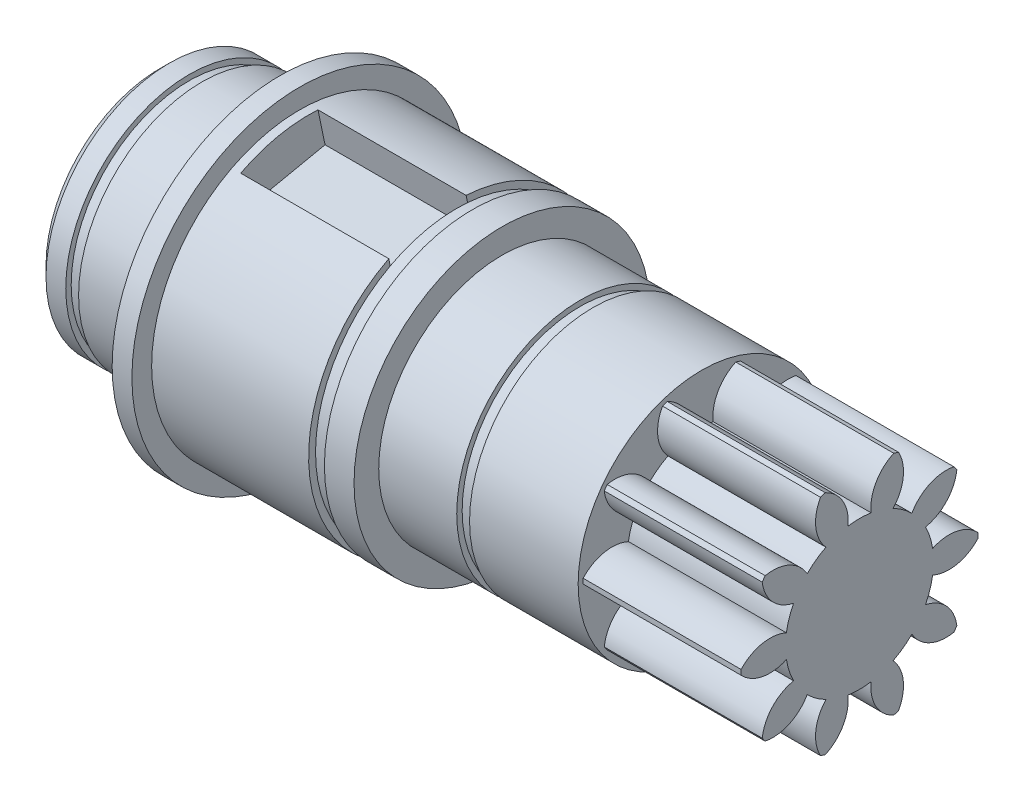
SolidWorks part; units mm, degrees
ref_plane "Plane1" through (0, 0, 0) normal (0, 0, 1) x (1, 0, 0)
ref_plane "Plane2" through (0, 0, 0) normal (0, 1, 0) x (1, 0, 0)
ref_plane "Plane3" through (0, 0, 0) normal (1, 0, 0) x (0, 0, -1)
sketch "HoldingSke" plane through (0, 0, 0) normal (0, 1, 0) x (1, 0, 0)
  line L0 (0, 0) -> (0.4924, -0.0868)
  line L1 (-15, 0) -> (100, 0) construction
  line L2 (0, 0) -> (-2.1039, 2.3779)
  line L3 (0, 0) -> (-11.863, 4.5341)
  line L4 (0, 0) -> (8.5048, 1.4996)
  line L5 (0, 0) -> (-46.8476, -17.4728)
  line L6 (0, 0) -> (-13.2634, -8.9489)
  line L7 (-2.1039, 2.3779) -> (8.6586, 51.2059)
  line L8 (-76.2, 54.61) -> (-73.9, 54.61)
  line L9 (-71.009, 38.7566) -> (-53.1078, 45.2721)
  line L10 (-76.2, 71.12) -> (104.1128, 71.12)
  line L11 (0, 0) -> (-16, 0)
  line L12 (-76.2, 101.6) -> (-76.133, 101.6)
  line L13 (24.9733, 27.94) -> (52.9518, 28.4284)
  line L14 (24.9733, 27.94) -> (24.9743, 27.94)
  line L15 (24.9733, 27.94) -> (100.4006, 29.5858)
  line L16 (-63.627, -2) -> (-12.827, -2)
  circle A0 centre (0, 0) radius 8
  circle A1 centre (0, 0) radius 7.499
  circle A2 centre (0, 0) radius 37.5
  circle A3 centre (0, 0) radius 7.4736
  dimension "MHD" = 14.998
  dimension "Hub_dia" = 75
  dimension "Bore" = 16
  dimension "MBD" = 14.9472
  dimension "Num_teeth" = 10
  dimension "Pitch_radius" = 180.3128
  dimension "Pitch" = 0.5
  dimension "Width" = 16
  dimension "Overall_len" = 50
  dimension "Show_teeth" = 10
  dimension "Thickness" = 16
  dimension "OAL" = 50.0001
  dimension "T_dim" = 2.3
  dimension "Ap" = 20
  dimension "H" = 19.05
  dimension "Backlash" = 0.067
  dimension "Addendum_fac" = 1
  dimension "Dedendum_fac" = 1.25
  dimension "Clearance_fac" = 0.25
  dimension "Dedendum_add" = 0.001
  dimension "Module" = 2
sketch "BasProSke" plane through (0, 0, 0) normal (0, 1, 0) x (1, 0, 0)
  line L0 (-10, 0) -> (60, 0) construction
  line L1 (0, 0) -> (0, 12)
  line L2 (0, 0) -> (16, 0)
  line L3 (16, 0) -> (16, 12)
  line L4 (16, 12) -> (0, 12)
  dimension "Diameter" = 24
  dimension "Thickness" = 16
revolve "Base-Revolve" add sketch "BasProSke" angle 360 about L0
sketch "TooCutSke" plane through (0, 0, 0) normal (1, 0, 0) x (0, 0, -1)
  line L1 (0, 0) -> (0, 107) construction
  line L2 (0, 0) -> (-1.6814, 9.8576) construction
  line L3 (0, 0) -> (-6.1153, 18.8209) construction
  line L4 (-1.6814, 9.8576) -> (-3.0576, 9.4105) construction
  arc A0 (1.1737, 7.4066) -> (-1.1737, 7.4066) centre (0, 0) ccw
  arc A1 (3.4979, 11.5054) -> (-3.4979, 11.5054) centre (0, 0) ccw
  circle A2 centre (0, 0) radius 10 construction
  circle A3 centre (0, 0) radius 9.3969 construction
  arc A4 (-1.1737, 7.4066) -> (-3.4979, 11.5054) centre (-5.1477, 7.8615) ccw
  arc A5 (3.4979, 11.5054) -> (1.1737, 7.4066) centre (5.1477, 7.8615) ccw
  dimension "Root_dia" = 14.998
  dimension "Overcut_dia" = 24.0508
  dimension "Pitch_dia" = 20
  dimension "Base_dia" = 18.7939
  dimension "Flank_rad" = 4
  dimension "Half_ang" = 18
  dimension "Half_CT" = 1.4471
extrude "ToothCut" cut sketch "TooCutSke" along normal through all
fillet "Breaks" [suppressed] radius 0.04
fillet "RootFillets" [suppressed] radius 0.501
pattern_circular "TeethCuts" count 10 every 36 about axis through (-10, 0, 0) along (1, 0, 0) of "ToothCut", "RootFillets", "Breaks"
sketch "HubNeaOneSke" plane through (0, 0, 0) normal (-1, 0, 0) x (0, 0, 1)
  circle A0 centre (0, 0) radius 7.499
  dimension "Diameter" = 14.998
extrude "HubNearOne" [suppressed] add sketch "HubNeaOneSke" along normal blind 34.0001
sketch "HubNeaBotSke" plane through (0, 0, 0) normal (-1, 0, 0) x (0, 0, 1)
  circle A0 centre (0, 0) radius 7.499
  dimension "Diameter" = 14.998
extrude "HubNearBoth" [suppressed] add sketch "HubNeaBotSke" along normal blind 17
ref_plane "FarPln" through (16, 0, 0) normal (1, 0, 0) x (0, 0, -1)
sketch "HubFarSke" plane through (16, 0, 0) normal (1, 0, 0) x (0, 0, -1)
  circle A0 centre (0, 0) radius 7.499
  dimension "Diameter" = 14.998
extrude "HubFar" [suppressed] add sketch "HubFarSke" along normal blind 17
sketch "BorSke" plane through (0, 0, 0) normal (1, 0, 0) x (0, 0, -1)
  circle A0 centre (0, 0) radius 7.4736
  dimension "Diameter" = 14.9472
extrude "Bore" cut sketch "BorSke" along normal mid plane 100.0001
sketch "KeySke" plane through (0, 0, 0) normal (1, 0, 0) x (0, 0, -1)
  line L0 (-2.5, 0) -> (-2.5, 9.7736)
  line L1 (-2.5, 9.7736) -> (2.5, 9.7736)
  line L2 (2.5, 9.7736) -> (2.5, 0)
  line L3 (0, 0) -> (0, 34) construction
  line L4 (-2.5, 0) -> (2.5, 0)
  dimension "Offset" = 9.7736
  dimension "Width" = 5
extrude "Keyway" [suppressed] cut sketch "KeySke" along normal mid plane 100.0001
pattern_circular "Keyway2" [suppressed] count 2 every 90 about axis through (-10, 0, 0) along (1, 0, 0)
sketch "Esquisse1" plane through (16, 0, 0) normal (1, 0, 0) x (0, 0, -1)
  circle A0 centre (0, 0) radius 7.4736
  circle A2 centre (0, 0) radius 7.4736 construction
extrude "Extrusion2" add sketch "Esquisse1" against normal blind 16
sketch "Esquisse2" plane through (0, 0, 0) normal (-1, 0, 0) x (0, 0, 1)
  circle A0 centre (0, 0) radius 12.5
  dimension "D1" = 25
extrude "Extrusion3" add sketch "Esquisse2" along normal blind 11
sketch "Esquisse3" plane through (-11, 0, 0) normal (-1, 0, 0) x (0, 0, 1)
  circle A0 centre (0, 0) radius 11.95
  dimension "D1" = 23.9
extrude "Extrusion4" add sketch "Esquisse3" along normal blind 1.3
sketch "Esquisse4" plane through (-12.3, 0, 0) normal (-1, 0, 0) x (0, 0, 1)
  circle A0 centre (0, 0) radius 12.5
  dimension "D1" = 25
extrude "Extrusion5" add sketch "Esquisse4" along normal blind 7.9
sketch "Esquisse5" plane through (-20.2, 0, 0) normal (-1, 0, 0) x (0, 0, 1)
  circle A0 centre (0, 0) radius 15
  dimension "D1" = 30
extrude "Extrusion6" add sketch "Esquisse5" along normal blind 3
sketch "Esquisse6" plane through (-23.2, 0, 0) normal (-1, 0, 0) x (0, 0, 1)
  circle A0 centre (0, 0) radius 14.3
  dimension "D1" = 28.6
extrude "Extrusion7" add sketch "Esquisse6" along normal blind 1.6
sketch "Esquisse7" plane through (-24.8, 0, 0) normal (-1, 0, 0) x (0, 0, 1)
  circle A0 centre (0, 0) radius 15
  dimension "D1" = 30
extrude "Extrusion8" add sketch "Esquisse7" along normal blind 15.9
sketch "Esquisse8" plane through (-40.7, 0, 0) normal (-1, 0, 0) x (0, 0, 1)
  circle A0 centre (0, 0) radius 17
  dimension "D1" = 34
extrude "Extrusion9" add sketch "Esquisse8" along normal blind 2
sketch "Esquisse9" plane through (-42.7, 0, 0) normal (-1, 0, 0) x (0, 0, 1)
  circle A0 centre (0, 0) radius 12.5
  dimension "D1" = 25
extrude "Extrusion11" add sketch "Esquisse9" along normal blind 7.9
sketch "Esquisse10" plane through (-50.6, 0, 0) normal (-1, 0, 0) x (0, 0, 1)
  circle A0 centre (0, 0) radius 11.95
  dimension "D1" = 23.9
extrude "Extrusion12" add sketch "Esquisse10" along normal blind 1.3
sketch "Esquisse11" plane through (-51.9, 0, 0) normal (-1, 0, 0) x (0, 0, 1)
  circle A0 centre (0, 0) radius 12.5
  dimension "D1" = 25
extrude "Extrusion13" add sketch "Esquisse11" along normal blind 3
chamfer "Chanfrein1" distance 1 angle 45 1 edges at (-54.9, 0, 12.5)
sketch "Esquisse12" plane through (-24.8, 0, 0) normal (1, 0, 0) x (0, 0, -1)
  line L0 (0.2289, 18.3955) -> (1.6658, 11.5446)
  line L1 (0.2289, 18.3955) -> (-7.6007, 16.7534)
  line L2 (-7.6007, 16.7534) -> (-6.1639, 9.9025)
  line L3 (-6.1639, 9.9025) -> (1.6658, 11.5446)
  dimension "D1" = 7
extrude "Enlèv. mat.-Extru.1" cut sketch "Esquisse12" against normal blind 15
equation "' \"Module@HoldingSke\" = 6.35"
equation "' \"Num_teeth@HoldingSke\" = 12"
equation "' \"Ap@HoldingSke\" =  20"
equation "' \"Width@HoldingSke\" = 0.5 * 25.4"
equation "' \"Hub_dia@HoldingSke\"= 1 * 25.4"
equation "' \"Overall_len@HoldingSke\" = 1.0 * 25.4"
equation "' \"Bore@HoldingSke\" = 0.75 * 25.4"
equation "' \"T_dim@HoldingSke\" = 0.1 * 25.4"
equation "' \"Width@KeySke\" = 0.25 * 25.4"
equation "' \"Show_teeth@HoldingSke\" = 13"
equation "' \"Backlash@HoldingSke\" = 0.009 * 25.4"
equation "' \"Addendum_fac@HoldingSke\" = 1.0"
equation "' \"Dedendum_fac@HoldingSke\" = 1.25"
equation "' \"Dedendum_add@HoldingSke\" = 0.00005 * 25.4"
equation "' \"Clearance_fac@HoldingSke\" = 0.25"
equation "\"Pitch@HoldingSke\" = 1 / \"Module@HoldingSke\""
equation "\"Overcut_dia@TooCutSke\" = (\"Num_teeth@HoldingSke\" + 2 * \"Addendum_fac@HoldingSke\") / \"Pitch@HoldingSke\" + 0.002 * 25.4"
equation "\"Pitch_dia@TooCutSke\" = \"Num_teeth@HoldingSke\" / \"Pitch@HoldingSke\""
equation "\"Base_dia@TooCutSke\" = \"Num_teeth@HoldingSke\" / \"Pitch@HoldingSke\" * cos((\"Ap@HoldingSke\"  * 3.14159265 / 180))"
equation "\"Root_dia@TooCutSke\" = (\"Num_teeth@HoldingSke\" + 2) / \"Pitch@HoldingSke\" - 2 * (\"Addendum_fac@HoldingSke\" + \"Dedendum_fac@HoldingSke\") / \"Pitch@HoldingSke\" - \"Dedendum_add@HoldingSke\" * 2"
equation "\"Half_ang@TooCutSke\" = 180 / \"Num_teeth@HoldingSke\""
equation "\"Half_CT@TooCutSke\" = \"Num_teeth@HoldingSke\" / \"Pitch@HoldingSke\" * sin((3.14159265 / 2 / \"Num_teeth@HoldingSke\")) / 2 - 7 * \"Backlash@HoldingSke\" / 4"
equation "\"Flank_rad@TooCutSke\" = \"Num_teeth@HoldingSke\" / \"Pitch@HoldingSke\" / 5"
equation "\"Radius@RootFillets\" = \"Clearance_fac@HoldingSke\" / \"Pitch@HoldingSke\" + \"Dedendum_add@HoldingSke\""
equation "\"Break_rad@Breaks\" = 0.02 / \"Pitch@HoldingSke\""
equation "\"Thickness@HoldingSke\" = \"Width@HoldingSke\""
equation "\"OAL@HoldingSke\" = \"Thickness@HoldingSke\""
equation "\"MHD@HoldingSke\" = (\"Num_teeth@HoldingSke\" + 2) / \"Pitch@HoldingSke\" - 2 * (\"Addendum_fac@HoldingSke\" + \"Dedendum_fac@HoldingSke\")  / \"Pitch@HoldingSke\" - \"Dedendum_add@HoldingSke\" * 2"
equation "\"MBD@HoldingSke\" = (\"Num_teeth@HoldingSke\" + 2) / \"Pitch@HoldingSke\" - 2 * (\"Addendum_fac@HoldingSke\" + \"Dedendum_fac@HoldingSke\")  / \"Pitch@HoldingSke\" - \"Dedendum_add@HoldingSke\" * 2 - 0.002 * 25.4"
equation "\"MHD@HoldingSke\" = ((sgn( \"MHD@HoldingSke\" - \"Hub_dia@HoldingSke\" )-1)*( \"MHD@HoldingSke\" - \"Hub_dia@HoldingSke\" ))/-2+ \"Hub_dia@HoldingSke\""
equation "\"MBD@HoldingSke\" = ((sgn( \"MBD@HoldingSke\" - \"Bore@HoldingSke\" )-1)*( \"MBD@HoldingSke\" - \"Bore@HoldingSke\" ))/-2+ \"Bore@HoldingSke\""
equation "\"OAL@HoldingSke\" = ((sgn( \"OAL@HoldingSke\" - \"Overall_len@HoldingSke\" )+1)*( \"OAL@HoldingSke\" - \"Overall_len@HoldingSke\" ))/2 + \"Overall_len@HoldingSke\" + 0.000002 * 25.4"
equation "\"Num_teeth@TeethCuts\" = int( \"Show_teeth@HoldingSke\" ) + 1"
equation "\"Num_teeth@TeethCuts\" = ((sgn( \"Num_teeth@TeethCuts\" - \"Num_teeth@HoldingSke\" )-1)*( \"Num_teeth@TeethCuts\" - \"Num_teeth@HoldingSke\" ))/-2+ \"Num_teeth@HoldingSke\""
equation "\"Num_teeth@TeethCuts\" = ((sgn( \"Num_teeth@TeethCuts\" - 2.0)+1)*( \"Num_teeth@TeethCuts\" - 2.0))/2 +2.0"
equation "\"Angle@TeethCuts\" = 360.0 / \"Num_teeth@HoldingSke\""
equation "\"Diameter@BasProSke\" = (\"Num_teeth@HoldingSke\" + 2 * \"Addendum_fac@HoldingSke\") / \"Pitch@HoldingSke\""
equation "\"Thickness@BasProSke\"  = \"Thickness@HoldingSke\""
equation "' \"Fillet_rad@BasProSke\" =  \"Thickness@HoldingSke\" * 0.05"
equation "\"MHD@HoldingSke\" = ((sgn( \"MHD@HoldingSke\" - \"Root_dia@TooCutSke\" )-1)*( \"MHD@HoldingSke\" - \"Root_dia@TooCutSke\" ))/-2+ \"Root_dia@TooCutSke\""
equation "\"Diameter@HubNeaOneSke\" = \"MHD@HoldingSke\""
equation "\"Length@HubNearOne\" = \"OAL@HoldingSke\" - \"Thickness@BasProSke\""
equation "\"Diameter@HubNeaBotSke\" = \"MHD@HoldingSke\""
equation "\"Length@HubNearBoth\" = ( \"OAL@HoldingSke\" - \"Thickness@BasProSke\" ) / 2.0"
equation "\"Thickness@FarPln\" = \"Thickness@BasProSke\""
equation "\"Diameter@HubFarSke\" = \"MHD@HoldingSke\""
equation "\"Length@HubFar\" = ( \"OAL@HoldingSke\" - \"Thickness@BasProSke\" ) / 2.0"
equation "\"Diameter@BorSke\" = \"MBD@HoldingSke\""
equation "\"D1@Bore\" = \"OAL@HoldingSke\" * 2.0"
equation "\"D1@Keyway\" = \"OAL@HoldingSke\" * 2.0"
equation "\"Offset@KeySke\" = \"T_dim@HoldingSke\" + \"MBD@HoldingSke\" / 2.0"
